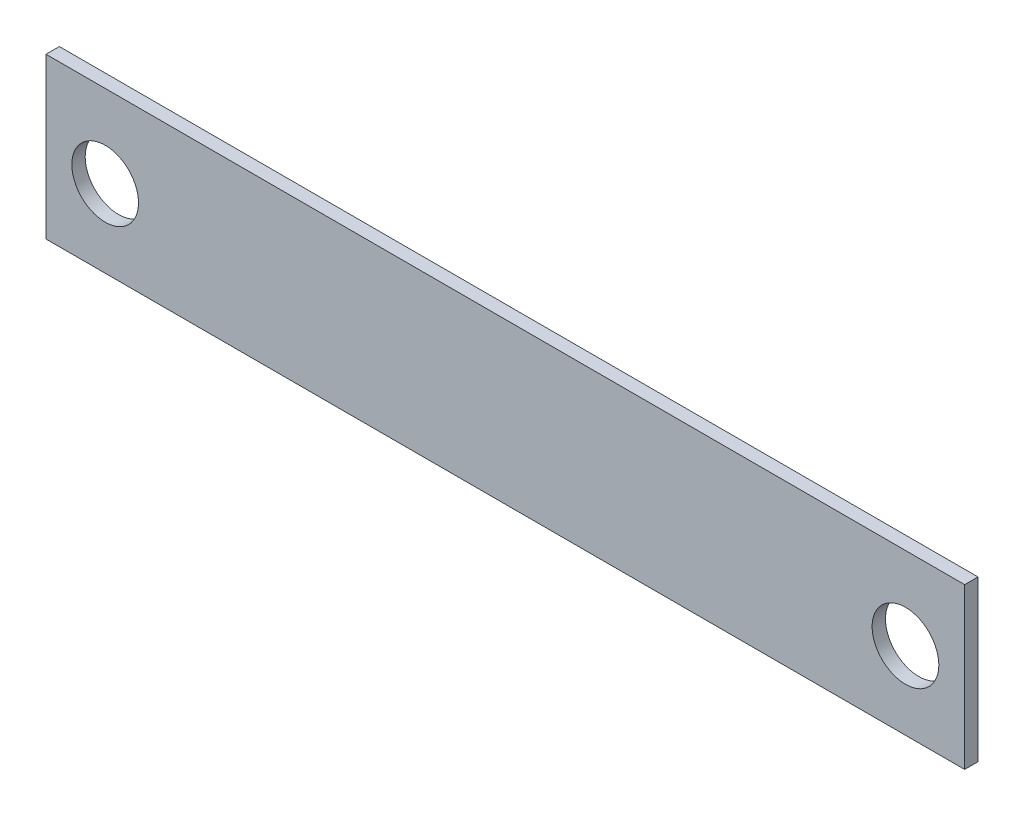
SolidWorks part; units mm, degrees
ref_plane "Front" through (0, 0, 0) normal (0, 0, 1) x (1, 0, 0)
ref_plane "Top" through (0, 0, 0) normal (0, 1, 0) x (1, 0, 0)
ref_plane "Right" through (0, 0, 0) normal (1, 0, 0) x (0, 0, -1)
sketch "Sketch1" plane through (0, 0, 0) normal (0, 0, 1) x (1, 0, 0)
  line L1 (0, 0) -> (3498.85, 0)
  line L2 (0, 0) -> (0, 609.6)
  line L3 (0, 609.6) -> (3498.85, 609.6)
  line L4 (3498.85, 0) -> (3498.85, 609.6)
  dimension "D1" = 3498.85
  dimension "D2" = 609.6
extrude "Boss-Extrude1" add sketch "Sketch1" along normal blind 50.8
sketch "Sketch2" plane through (0, 0, 0) normal (0, 0, -1) x (-1, 0, 0)
  line L0 (0, 0) -> (-3498.85, 0) construction
  line L1 (0, 609.6) -> (0, 0) construction
  circle A0 centre (-225.425, 295.275) radius 127
  dimension "D1" = 254
  dimension "D2" = 295.275
  dimension "D3" = 225.425
extrude "Cut-Extrude1" cut sketch "Sketch2" against normal through all
sketch "Sketch3" plane through (0, 0, 50.8) normal (0, 0, 1) x (1, 0, 0)
  line L0 (3498.85, 0) -> (3498.85, 609.6) construction
  line L1 (0, 0) -> (3498.85, 0) construction
  circle A0 centre (3273.425, 295.275) radius 127
  dimension "D1" = 254
  dimension "D2" = 225.425
  dimension "D3" = 295.275
extrude "Cut-Extrude2" cut sketch "Sketch3" against normal through all
